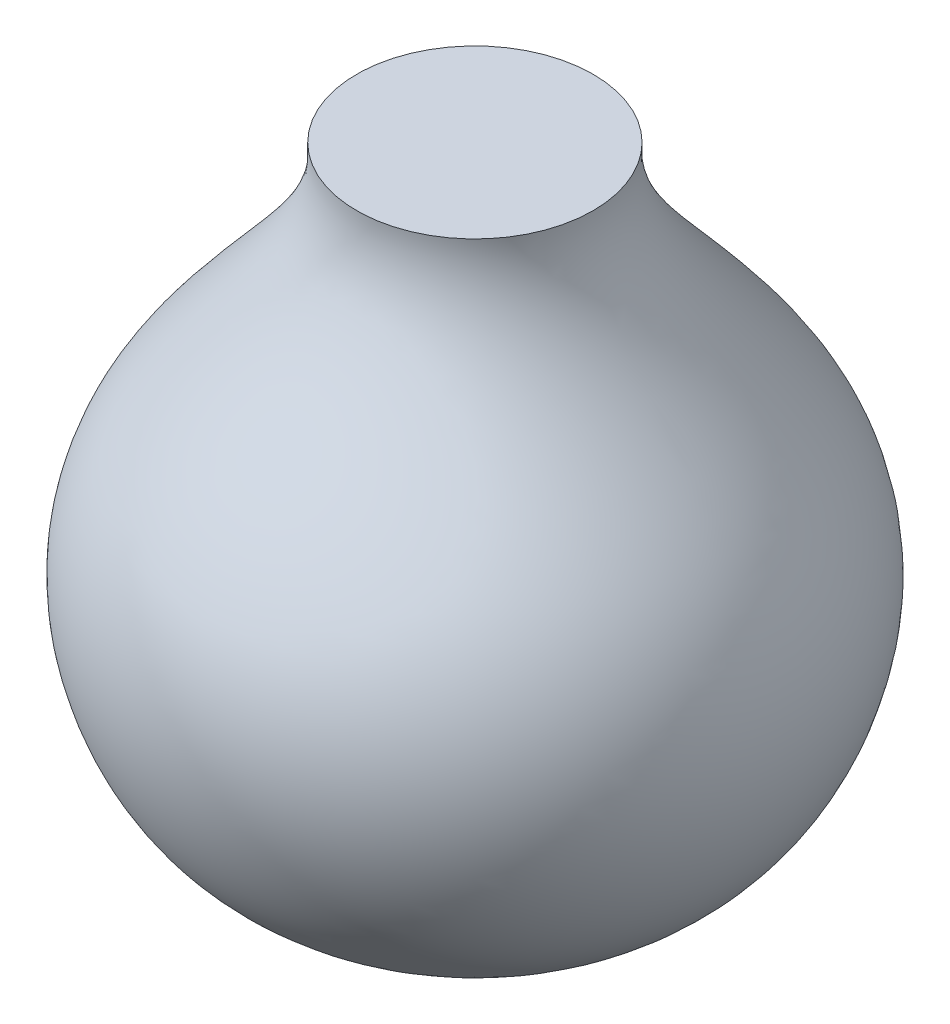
SolidWorks part; units mm, degrees
ref_plane "Front Plane" through (0, 0, 0) normal (0, 0, 1) x (1, 0, 0)
ref_plane "Top Plane" through (0, 0, 0) normal (0, 1, 0) x (1, 0, 0)
ref_plane "Right Plane" through (0, 0, 0) normal (1, 0, 0) x (0, 0, -1)
sketch "Sketch1" plane through (0, 0, 0) normal (0, 0, 1) x (1, 0, 0)
  line L0 (0, 0) -> (0, 65) construction
  line L1 (12, 65) -> (0, 65)
  line L2 (-13.4672, 0) -> (13.495, 0) construction
  line L3 (0, 0) -> (0, 65)
  spline S0 degree 3 poles (12, 65) (11.2485, 55.7709) (29.0632, 43.5951) (32.0384, 25.3898) (24.7882, 6.8591) (13.8872, 0) (0, 0) knots 0 0 0 0 0.354785 0.603738 0.671371 1 1 1 1
  point P5 (0, 0)
  point P9 (0, 0)
  dimension "D1" = 12
  dimension "D2" = 65
revolve "Revolve1" add sketch "Sketch1" angle 360 about L3
